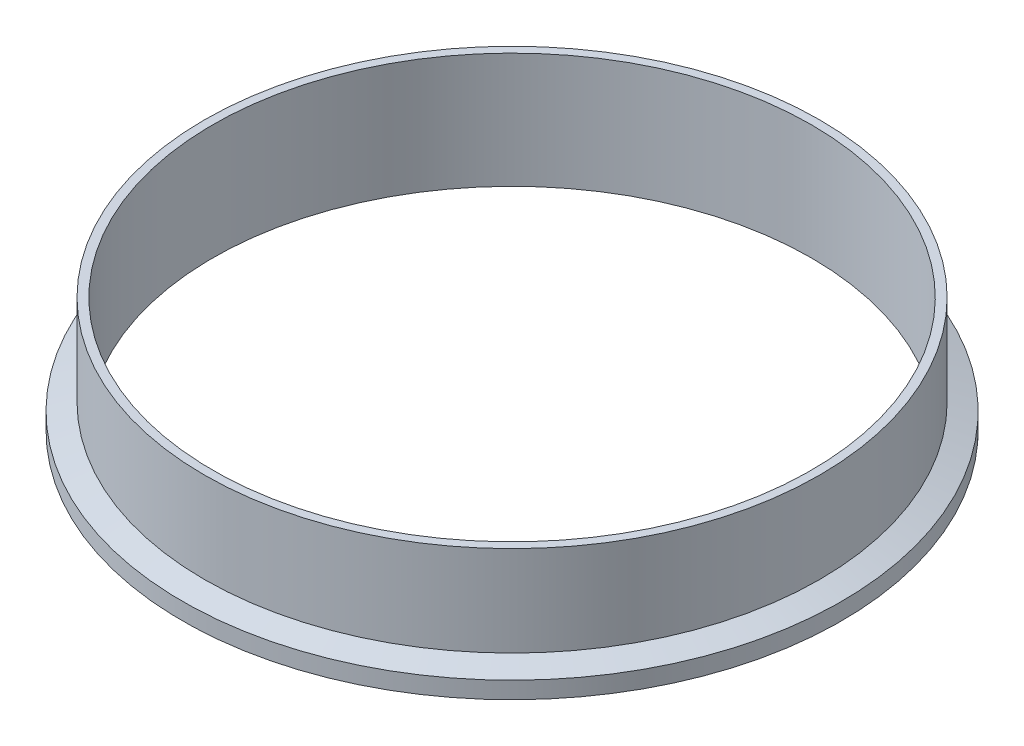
SolidWorks part; units mm, degrees
ref_plane "Front Plane" through (0, 0, 0) normal (0, 0, 1) x (1, 0, 0)
ref_plane "Top Plane" through (0, 0, 0) normal (0, 1, 0) x (1, 0, 0)
ref_plane "Right Plane" through (0, 0, 0) normal (1, 0, 0) x (0, 0, -1)
sketch "Sketch1" plane through (0, 0, 0) normal (0, 0, 1) x (1, 0, 0)
  line L0 (0, 0) -> (0, 38.1) construction
  line L1 (0, 38.1) -> (-101.6, 38.1)
  line L2 (-101.6, 38.1) -> (-101.6, 8.2228)
  line L3 (-101.6, 8.2228) -> (-108.839, 5.588)
  line L4 (-108.839, 5.588) -> (-108.839, 0)
  line L5 (-108.839, 0) -> (-105.3992, 0)
  line L6 (-101.7632, 0) -> (0, 0)
  line L7 (0, 0) -> (0, 38.1)
  line L8 (0, 38.1) -> (-98.8314, 38.1)
  line L9 (-98.8314, 38.1) -> (-98.8314, 0)
  line L10 (-98.8314, 0) -> (0, 0)
  line L11 (0, 0) -> (-0.1846, 0.0129)
  arc A0 (-104.6767, 0.4745) -> (-102.4857, 0.4745) centre (-103.5812, 0) cw
  arc A1 (-101.7632, 0) -> (-102.4857, 0.4745) centre (-101.7632, 0.7874) cw
  arc A2 (-104.6767, 0.4745) -> (-105.3992, 0) centre (-105.3992, 0.7874) cw
  point P12 (-102.3874, 0)
  dimension "D6" = 1.1938
  dimension "D7" = 0.7874
  dimension "D1" = 101.6
  dimension "D2" = 5.588
  dimension "D3" = 108.839
  dimension "D4" = 70
  dimension "D5" = 103.5812
  dimension "D8" = 2.7686
  dimension "D9" = 38.1
revolve "Revolve2" add sketch "Sketch1" angle 360 about L0
